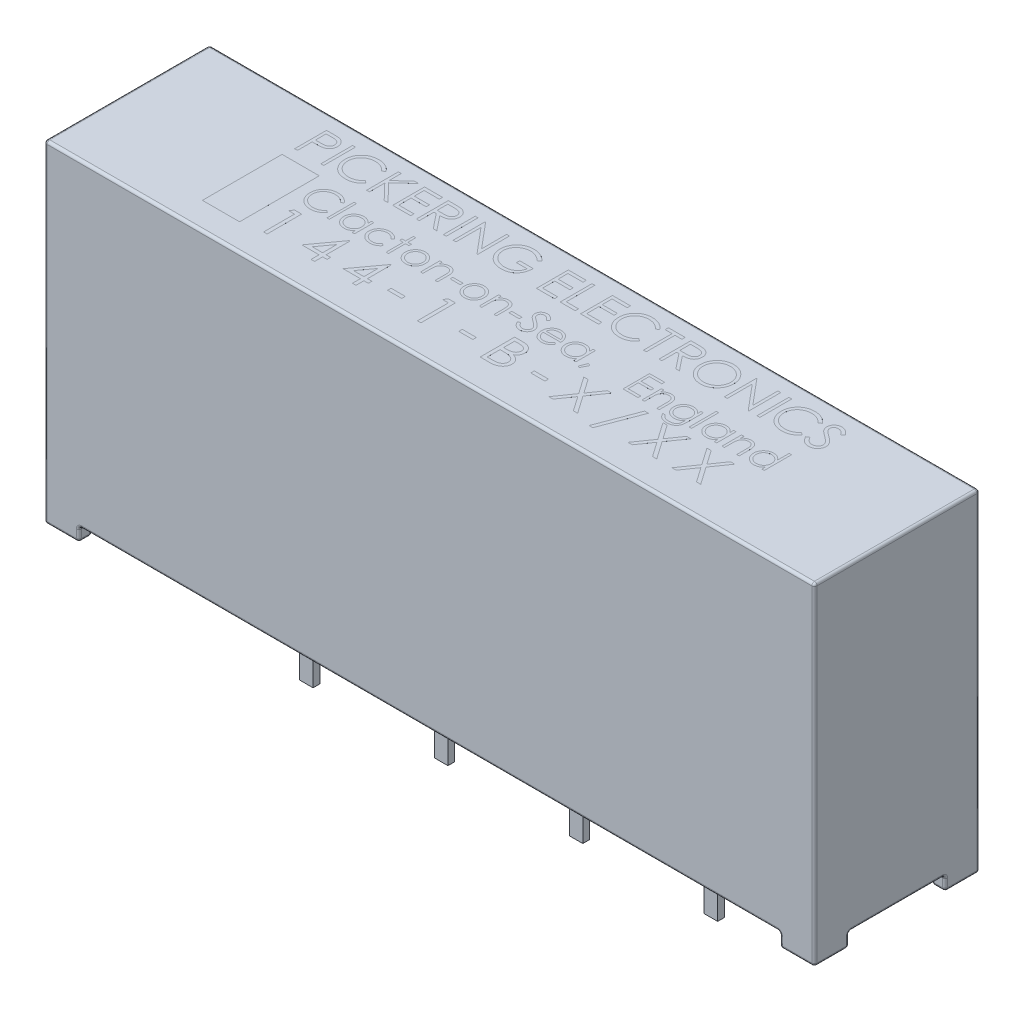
SolidWorks part; units mm, degrees
ref_plane "Front Plane" through (0, 0, 0) normal (0, 0, 1) x (1, 0, 0)
ref_plane "Top Plane" through (0, 0, 0) normal (0, 1, 0) x (1, 0, 0)
ref_plane "Right Plane" through (0, 0, 0) normal (1, 0, 0) x (0, 0, -1)
sketch "Sketch1" plane through (0, 0, 0) normal (0, 1, 0) x (1, 0, 0)
  line L1 (14.5, -3.11) -> (-14.5, -3.11)
  line L2 (14.5, -3.11) -> (14.5, 3.11)
  line L3 (14.5, 3.11) -> (-14.5, 3.11)
  line L4 (-14.5, -3.11) -> (-14.5, 3.11)
  line L5 (14.5, -3.11) -> (-14.5, 3.11) construction
  line L6 (14.5, 3.11) -> (-14.5, -3.11) construction
  point P0 (0, 0)
  dimension "D1" = 6.22
  dimension "D2" = 29
extrude "Main Body" add sketch "Sketch1" along normal blind 11.992
sketch "Sketch2" plane through (0, 0, 0) normal (0, -1, 0) x (1, 0, 0)
  line L1 (-14.5, 3.11) -> (-13.2, 3.11)
  line L2 (-14.5, 3.11) -> (-14.5, 1.81)
  line L3 (-14.5, 1.81) -> (-14, 1.81)
  line L4 (-13.2, 3.11) -> (-13.2, 2.61)
  line L7 (-13.2, 2.61) -> (-14, 2.61)
  line L8 (-14, 1.81) -> (-14, 2.61)
  dimension "D1" = 1.3
  dimension "D2" = 1.3
  dimension "D3" = 0.5
  dimension "D4" = 0.5
extrude "Original foot" add sketch "Sketch2" along normal blind 0.508
mirror "Left foot" about plane through (0, 0, 0) normal (0, 0, 1) of "Original foot"
mirror "Right Feet" about plane through (0, 0, 0) normal (1, 0, 0) of "Left foot", "Original foot"
sketch "Sketch3" plane through (0, 0, 0) normal (0, -1, 0) x (1, 0, 0)
  line L1 (-14.5, -1.81) -> (-14.5, 1.81) construction
  line L7 (-2.794, -0.127) -> (-2.286, -0.127)
  line L8 (-2.794, -0.127) -> (-2.794, 0.127)
  line L9 (-2.794, 0.127) -> (-2.286, 0.127)
  line L10 (-2.286, -0.127) -> (-2.286, 0.127)
  line L11 (-2.794, -0.127) -> (-2.286, 0.127) construction
  line L12 (-2.794, 0.127) -> (-2.286, -0.127) construction
  line L19 (2.286, -0.127) -> (2.794, -0.127)
  line L20 (2.286, -0.127) -> (2.286, 0.127)
  line L21 (2.286, 0.127) -> (2.794, 0.127)
  line L22 (2.794, -0.127) -> (2.794, 0.127)
  line L23 (2.286, -0.127) -> (2.794, 0.127) construction
  line L24 (2.286, 0.127) -> (2.794, -0.127) construction
  line L27 (7.366, -0.127) -> (7.874, -0.127)
  line L28 (7.366, -0.127) -> (7.366, 0.127)
  line L29 (7.366, 0.127) -> (7.874, 0.127)
  line L30 (7.874, -0.127) -> (7.874, 0.127)
  line L31 (7.366, -0.127) -> (7.874, 0.127) construction
  line L32 (7.366, 0.127) -> (7.874, -0.127) construction
  line L33 (-7.366, -0.127) -> (-7.874, -0.127)
  line L34 (-7.366, -0.127) -> (-7.366, 0.127)
  line L35 (-7.366, 0.127) -> (-7.874, 0.127)
  line L36 (-7.874, -0.127) -> (-7.874, 0.127)
  line L37 (-7.366, -0.127) -> (-7.874, 0.127) construction
  line L38 (-7.366, 0.127) -> (-7.874, -0.127) construction
  point P5 (-2.54, 0)
  point P15 (2.54, 0)
  point P20 (7.62, 0)
  point P26 (-7.62, 0)
  dimension "D2" = 6.88
  dimension "D3" = 0.508
  dimension "D4" = 0.254
  dimension "D5" = 0.508
  dimension "D6" = 0.254
  dimension "D10" = 5.08
  dimension "D12" = 0.508
  dimension "D13" = 0.254
  dimension "D14" = 5.08
  dimension "D15" = 0.254
  dimension "D16" = 0.508
  dimension "D17" = 5.08
extrude "Pins" add sketch "Sketch3" along normal blind 3.808
sketch "Sketch4" plane through (0, 11.992, 0) normal (0, 1, 0) x (-1, 0, 0)
  line L0 (9.65, -1.31) -> (-9.65, -1.31) construction
  line L1 (7.85, 0.34) -> (-9.65, 0.34) construction
  line L2 (7.85, 1.99) -> (-9.65, 1.99) construction
  line L3 (-14.5, -3.11) -> (14.5, -3.11) construction
  line L4 (14.5, -3.11) -> (14.5, 3.11) construction
  line L6 (14.5, 3.11) -> (-14.5, 3.11) construction
  line L7 (9.55, -0.89) -> (8.15, -0.89)
  line L8 (9.55, -0.89) -> (9.55, 2.11)
  line L9 (9.55, 2.11) -> (8.15, 2.11)
  line L10 (8.15, -0.89) -> (8.15, 2.11)
  text T0 "PICKERING ELECTRONICS" font "Century Gothic" height 1.2
  text T1 "Clacton-on-Sea,   England" font "Century Gothic" height 1
  text T2 "144-1-B-X/XX" font "Century Gothic" height 1.3
  dimension "D1" = 19.3
  dimension "D2" = 17.5
  dimension "D3" = 17.5
  dimension "D4" = 1.8
  dimension "D5" = 1.65
  dimension "D6" = 1.65
  dimension "D7" = 4.85
  dimension "D8" = 3
  dimension "D9" = 1.4
  dimension "D10" = 4.95
  dimension "D11" = 1
extrude "Lettering" add sketch "Sketch4" along normal blind 0.0001
fillet "Fillet1" radius 0.1 72 edges at (14, -0.254, -1.81) (14.5, -0.254, -1.81) (14.5, -0.254, 1.81) (14, -0.254, 1.81) (13.6, 0, -2.61) (14.25, 0, -1.81) (14.25, 0, 1.81) (13.6, 0, 2.61) (-13.6, 0, 2.61) (-13.6, 0, -2.61) (-13.6, -0.508, -2.61) (-13.85, -0.508, -3.11) (-14.5, -0.508, -2.46) (13.2, -0.254, -2.61) (13.2, -0.254, -3.11) (13.2, 0, -2.86) (14, -0.254, -2.61) (14, 0, -2.21) (14, -0.254, 2.61) (14, 0, 2.21) (13.2, -0.254, 2.61) (13.2, -0.254, 3.11) (13.2, 0, 2.86) (-14, -0.254, 1.81) (-14, -0.254, 2.61) (-14, 0, 2.21) (-13.2, -0.254, 2.61) (-14.25, -0.508, -1.81) (-14.5, -0.254, -1.81) (-14, -0.254, -1.81) (-14.25, 0, -1.81) (-14, -0.254, -2.61) (-14, -0.508, -2.21) (-14, 0, -2.21) (-13.2, -0.254, -2.61) (-13.2, -0.254, -3.11) (-13.2, -0.508, -2.86) (-13.2, 0, -2.86) (-13.85, -0.508, 3.11) (-13.2, -0.508, 2.86) (-13.6, -0.508, 2.61) (-14, -0.508, 2.21) (-14.25, -0.508, 1.81) (-14.5, -0.508, 2.46) (13.85, -0.508, -3.11) (13.2, -0.508, -2.86) (13.6, -0.508, -2.61) (14, -0.508, -2.21) (14.25, -0.508, -1.81) (14.5, -0.508, -2.46) (14.25, -0.508, 1.81) (14, -0.508, 2.21) (13.6, -0.508, 2.61) (13.2, -0.508, 2.86) (13.85, -0.508, 3.11) (14.5, -0.508, 2.46) (14.5, 0, 0) (0, 0, -3.11) (0, 11.992, -3.11) (14.5, 5.742, -3.11) (14.5, 11.992, 0) (14.5, 5.742, 3.11) (0, 11.992, 3.11) (-14.5, 11.992, 0) (-14.5, 5.742, -3.11) (-14.5, 5.742, 3.11)
